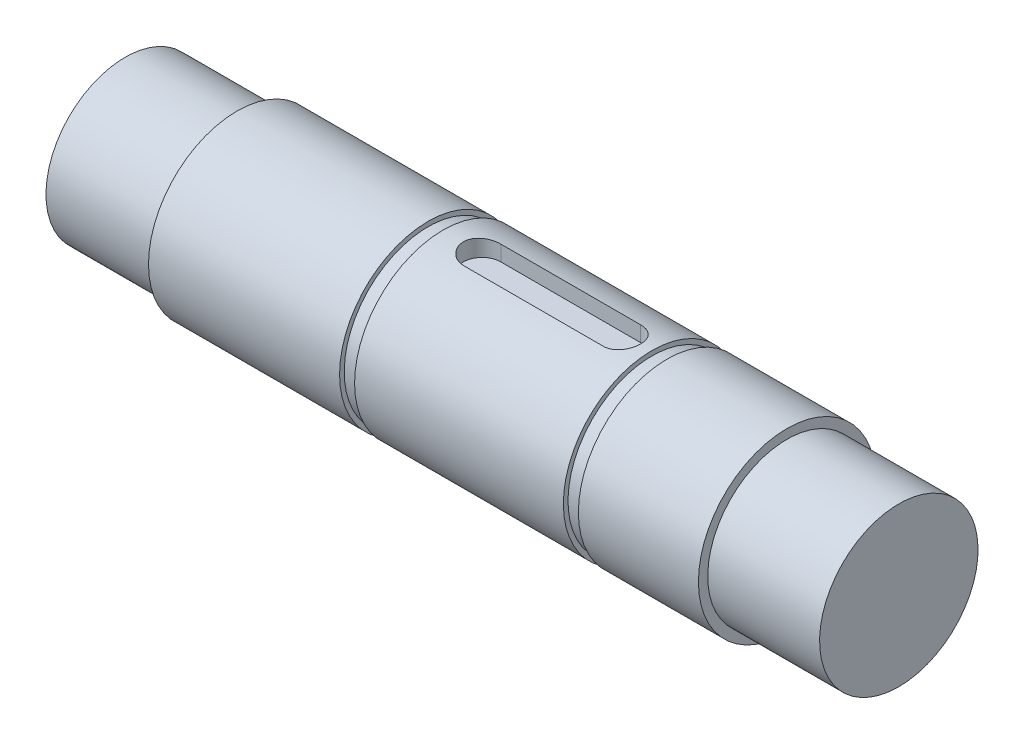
SolidWorks part; units mm, degrees
ref_plane "Front Plane" through (0, 0, 0) normal (0, 0, 1) x (1, 0, 0)
ref_plane "Top Plane" through (0, 0, 0) normal (0, 1, 0) x (1, 0, 0)
ref_plane "Right Plane" through (0, 0, 0) normal (1, 0, 0) x (0, 0, -1)
sketch "Sketch2" plane through (0, 0, 0) normal (0, 0, 1) x (1, 0, 0)
  line L0 (70.9267, 0.911) -> (70.9267, 9.411)
  line L2 (82.9267, 0.911) -> (82.9267, -0.089)
  line L3 (141.9267, 0.911) -> (141.9267, -0.089)
  line L4 (70.9267, 0.911) -> (82.9267, 0.911)
  line L5 (70.9267, 9.411) -> (153.9267, 9.411) construction
  line L6 (105.0367, -0.089) -> (127.4367, -0.089)
  line L9 (141.9267, 0.911) -> (153.9267, 0.911)
  line L11 (153.9267, 0.911) -> (153.9267, 9.411)
  line L12 (105.0367, -0.089) -> (105.0367, 0.411)
  line L22 (105.0367, 0.411) -> (103.4267, 0.411)
  line L23 (103.4267, 0.411) -> (103.4267, -0.089)
  line L24 (103.4267, -0.089) -> (82.9267, -0.089)
  line L25 (127.4367, -0.089) -> (127.4367, 0.411)
  line L26 (127.4367, 0.411) -> (129.0467, 0.411)
  line L27 (129.0467, 0.411) -> (129.0467, -0.089)
  line L28 (129.0467, -0.089) -> (141.9267, -0.089)
  dimension "D10" = 1
  dimension "D3" = 8.5
  dimension "D4" = 1.61
  dimension "D6" = 1.61
  dimension "D8" = 0.5
  dimension "D1" = 0.5
  dimension "D2" = 12
  dimension "D5" = 12
  dimension "D7" = 0.5
  dimension "D9" = 1
revolve "Revolve2" add sketch "Sketch2" angle 360 about L5
ref_plane "Plane1" through (116.7204, 0, 0) normal (-1, 0, 0) x (0, 0, 1)
sketch "Sketch8" plane through (116.7204, 0, 0) normal (-1, 0, 0) x (0, 0, 1)
  line L0 (0, 18.9043) -> (0, 0) construction
  line L1 (-2, 17.0384) -> (2, 17.0384)
  line L2 (2, 17.0384) -> (2, 18.9384)
  line L3 (-2, 17.0384) -> (-2, 18.9384)
  line L4 (-2, 18.9384) -> (2, 18.9384)
  dimension "D1" = 4
  dimension "D2" = 1.9
extrude "Cut-Extrude1" cut sketch "Sketch8" against normal mid plane 15
ref_plane "Plane2" through (0, 17.0384, 0) normal (0, 1, 0) x (1, 0, 0)
sketch "Sketch9" plane through (0, 17.0384, 0) normal (0, 1, 0) x (1, 0, 0)
  line L1 (109.2204, 2) -> (124.2204, 2)
  line L3 (109.2204, -2) -> (124.2204, -2)
  arc A0 (124.2204, 2) -> (124.2204, -2) centre (124.2204, 0) cw
  arc A1 (109.2204, 2) -> (109.2204, -2) centre (109.2204, 0) ccw
extrude "Cut-Extrude2" cut sketch "Sketch9" along normal blind 10
